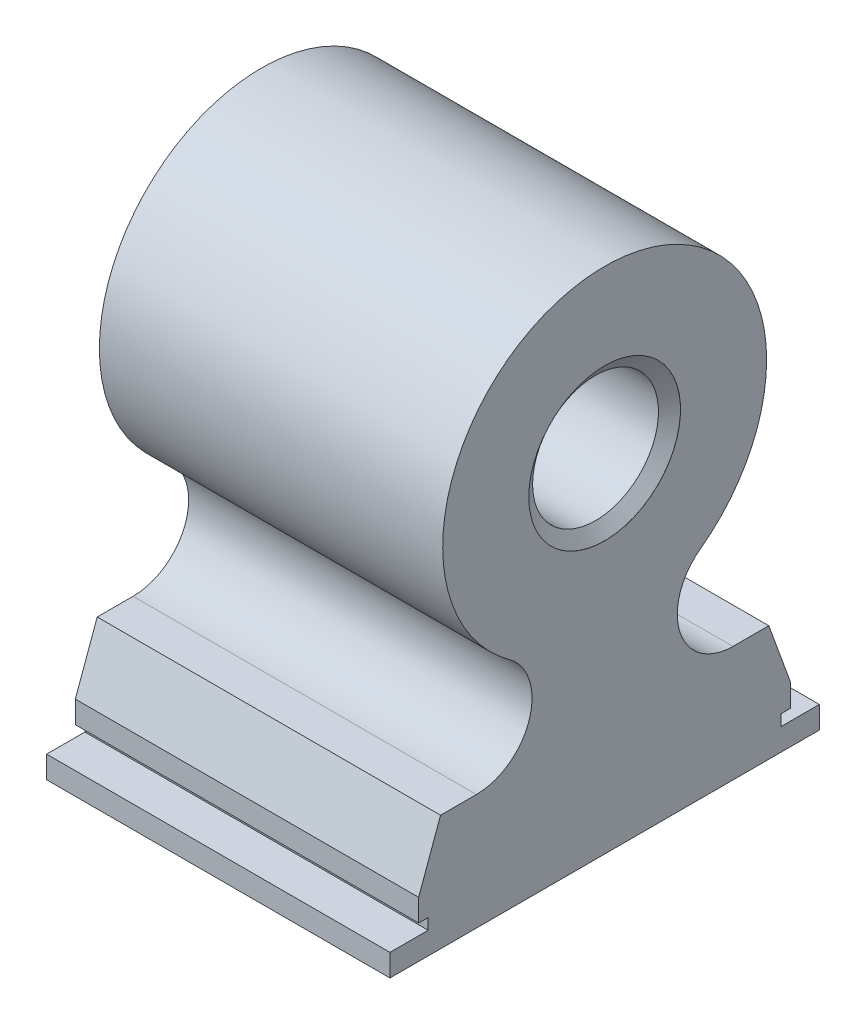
SolidWorks part; units mm, degrees
ref_plane "Plane1" through (0, 0, 0) normal (0, 0, 1) x (1, 0, 0)
ref_plane "Plane2" through (0, 0, 0) normal (0, 1, 0) x (1, 0, 0)
ref_plane "Plane3" through (0, 0, 0) normal (1, 0, 0) x (0, 0, -1)
sketch "BodySke" plane through (0, 0, 0) normal (1, 0, 0) x (0, 0, -1)
  line L0 (-5.8928, -9.525) -> (5.8928, -9.525)
  line L1 (5.8928, -9.525) -> (5.8928, -8.9154)
  line L2 (5.8928, -8.9154) -> (4.8429, -8.9154)
  line L3 (-5.8928, -9.525) -> (-5.8928, -8.9154)
  line L4 (-5.8928, -8.9154) -> (-4.8429, -8.9154)
  line L5 (4.8429, -8.9154) -> (4.8429, -8.6106)
  line L6 (-4.8429, -8.9154) -> (-4.8429, -8.6106)
  line L7 (4.8429, -8.6106) -> (5.1054, -8.6106)
  line L8 (-4.8429, -8.6106) -> (-5.1054, -8.6106)
  line L9 (-3.5204, -6.35) -> (-4.5045, -6.35)
  line L10 (0, -0.7925) -> (4.5045, -0.7925) construction
  line L11 (4.5045, -6.35) -> (3.5204, -6.35)
  line L12 (0, 7.62) -> (0, -11.43) construction
  line L13 (7.62, 0) -> (-7.62, 0) construction
  line L14 (1.9939, -2.8908) -> (1.9939, -7.62) construction
  line L15 (-1.9939, -2.8908) -> (-1.9939, -7.62) construction
  line L16 (4.5045, -6.35) -> (5.1054, -8.001)
  line L17 (5.1054, -8.001) -> (5.1054, -8.6106)
  line L18 (-4.5045, -6.35) -> (-5.1054, -8.001)
  line L19 (-5.1054, -8.001) -> (-5.1054, -8.6106)
  circle A0 centre (0, 0) radius 1.7272
  arc A1 (2.6205, -3.5904) -> (-2.6205, -3.5904) centre (0, 0) ccw
  arc A2 (3.5204, -6.35) -> (2.6205, -3.5904) centre (3.5204, -4.8235) cw
  arc A3 (-2.6205, -3.5904) -> (-3.5204, -6.35) centre (-3.5204, -4.8235) cw
  dimension "Thread_min" = 3.4544
  dimension "C_dia" = 8.89
  dimension "J_dim" = 3.9878
  dimension "E_dim" = 11.7856
  dimension "D_dim" = 3.175
  dimension "Clinch_ht" = 0.6096
  dimension "Side_ht" = 0.6096
  dimension "Groove_wid" = 0.3048
  dimension "A_dim" = 10.2108
  dimension "Groove_overall" = 9.6859
  dimension "F_dim" = 9.525
  dimension "D12" = 20
  dimension "Advance" = 0.7925
extrude "Body" add sketch "BodySke" along normal blind 9.4234
revolve "EndChamfer" cut sketch "EndChamferSke" angle 360 about L11
sketch "EndChamferSke" plane through (0, 0, 0) normal (0, 0, 1) x (1, 0, 0)
  line L0 (-0.254, 2.0828) -> (0.0025, 2.0828)
  line L2 (0.0025, 2.0828) -> (0.2514, 1.7272)
  line L3 (0.2514, 1.7272) -> (-0.254, 1.7272)
  line L4 (-0.254, 1.7272) -> (-0.254, 2.0828)
  line L5 (9.6774, 2.0828) -> (9.4209, 2.0828)
  line L6 (9.4209, 2.0828) -> (9.172, 1.7272)
  line L7 (9.172, 1.7272) -> (9.6774, 1.7272)
  line L8 (9.6774, 1.7272) -> (9.6774, 2.0828)
  line L9 (0, 4.445) -> (0, -3.5904) construction
  line L10 (9.4234, -3.5904) -> (9.4234, 4.445) construction
  line L11 (-5.1059, 0) -> (14.0173, 0) construction
  line L12 (9.4234, 0) -> (0, 0) construction
  dimension "Inset" = 0.0025
  dimension "D2" = 34.99
  dimension "Inset_far" = 0.0025
  dimension "D3" = 0.254
  dimension "D4" = 0.254
  dimension "Thread_min" = 3.4544
  dimension "Thread_nominal" = 4.1656
sketch "ThdSchSke" [suppressed] plane through (0, 0, 0) normal (0, 0, 1) x (1, 0, 0)
  line L0 (-1.2331, 0) -> (11.43, 0) construction
  line L1 (6.0414, 0) -> (0.207, 0) construction
  line L2 (0.0025, 1.7272) -> (0.0025, -1.4224) construction
  line L3 (0.0025, -1.4224) -> (0.2071, -1.1303)
  line L4 (0.207, -1.1303) -> (6.0414, -1.1303) construction
  line L5 (0.0025, -1.4224) -> (-0.202, -1.1303)
  line L6 (-0.202, -1.1303) -> (0.2071, -1.1303)
  line L8 (0.0025, 1.4224) -> (0.0025, -1.4224) construction
  dimension "Vee_angle" = 70
  dimension "Thread_nominal" = 4.1656
revolve "ThreadSchematic" [suppressed] cut sketch "ThdSchSke" angle 360 about L0
pattern_linear "ThdSchPat" [suppressed]
equation "' \"Length@Body\" = 0.371"
equation "' \"A_dim@BodySke\" = 0.402"
equation "' \"C_dia@BodySke\" = 0.35"
equation "' \"D_dim@BodySke\" = 0.125"
equation "' \"E_dim@BodySke\" = 0.464"
equation "' \"F_dim@BodySke\" = 0.375"
equation "' \"J_dim@BodySke\" =  0.157"
equation "' \"Advance@BodySke\" = 0.0312"
equation "' \"Thread_min@BodySke\" = 0.136"
equation "' \"Thread_nominal@ThreadCosmetic\" = 0.164"
equation "\"Clinch_ht@BodySke\" = 0.04 * 0.6"
equation "\"Groove_wid@BodySke\" = \"Clinch_ht@BodySke\" / 2"
equation "\"Groove_overall@BodySke\" = \"A_dim@BodySke\" - ( \"E_dim@BodySke\" - \"A_dim@BodySke\") / 3"
equation "\"Side_ht@BodySke\" = \"Clinch_ht@BodySke\""
equation "\"Thread_nominal@EndChamferSke\" = \"Thread_nominal@ThreadCosmetic\""
equation "\"Thread_min@EndChamferSke\" = \"Thread_min@BodySke\""
equation "\"D2@EndChamferSke\" = \"Vee_angle@ThdSchSke\" / 2 - 0.01"
equation "\"Thread_nominal@ThdSchSke\" = \"Thread_nominal@ThreadCosmetic\""
equation "\"Num_threads@ThdSchPat\" = int(  ( \"Length@Body\" - \"Inset@EndChamferSke\" - \"Inset_far@EndChamferSke\" ) / \"Advance@BodySke\" + 0.999 )  + 1"
equation "\"Advance@ThdSchPat\" = (  \"Length@Body\" - \"Inset@EndChamferSke\" - \"Inset_far@EndChamferSke\"  ) /  (\"Num_threads@ThdSchPat\" - 1) 'relax it"
